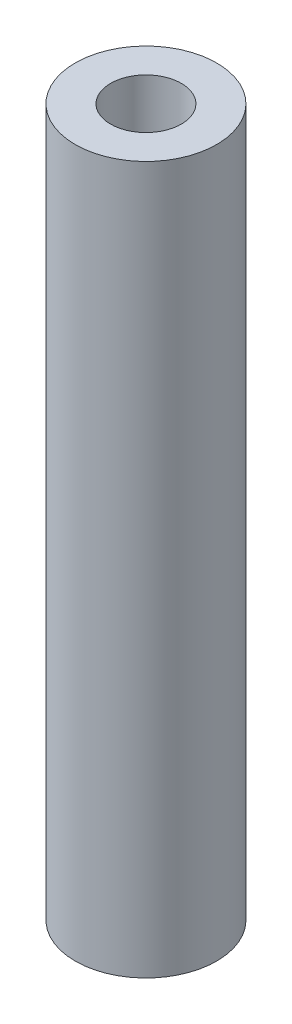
SolidWorks part; units mm, degrees
ref_plane "Front Plane" through (0, 0, 0) normal (0, 0, 1) x (1, 0, 0)
ref_plane "Top Plane" through (0, 0, 0) normal (0, 1, 0) x (1, 0, 0)
ref_plane "Right Plane" through (0, 0, 0) normal (1, 0, 0) x (0, 0, -1)
sketch "Sketch1" plane through (0, 0, 0) normal (0, 1, 0) x (1, 0, 0)
  circle A0 centre (0, 0) radius 1.27
  circle A1 centre (0, 0) radius 2.54
  dimension "D1" = 2.54
  dimension "D2" = 5.08
extrude "Boss-Extrude1" add sketch "Sketch1" along normal blind 25.4
